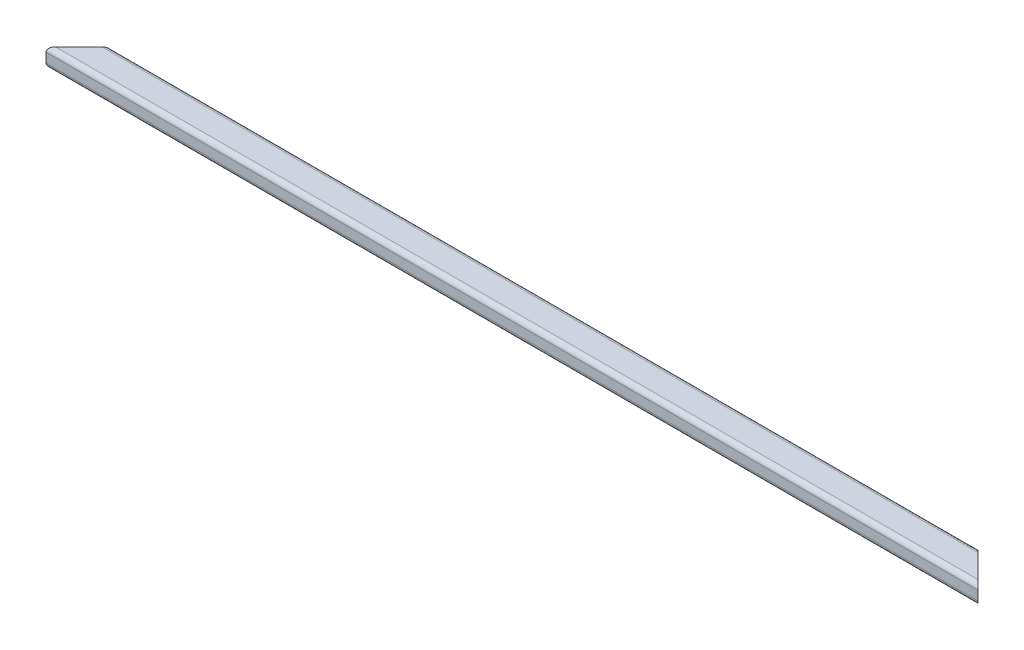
SolidWorks part; units mm, degrees
ref_plane "Plan1" through (0, 0, 0) normal (0, 0, 1) x (1, 0, 0)
ref_plane "Plan2" through (0, 0, 0) normal (0, 1, 0) x (1, 0, 0)
ref_plane "Plan3" through (0, 0, 0) normal (1, 0, 0) x (0, 0, -1)
sketch "Esquisse1" plane through (0, 0, 0) normal (1, 0, 0) x (0, 0, -1)
  line L0 (-17.5, 0) -> (17.5, 0) construction
  line L1 (-12.5, 10) -> (12.5, 10)
  line L2 (-17.5, 5) -> (-17.5, -5)
  line L3 (-12.5, -10) -> (12.5, -10)
  line L4 (17.5, 5) -> (17.5, -5)
  line L5 (0, -10) -> (0, 10) construction
  line L6 (-12.5, 7.5) -> (12.5, 7.5)
  line L7 (15, 5) -> (15, -5)
  line L8 (-12.5, -7.5) -> (12.5, -7.5)
  line L9 (-15, 5) -> (-15, -5)
  arc A0 (17.5, 5) -> (12.5, 10) centre (12.5, 5) ccw
  arc A1 (-17.5, 5) -> (-12.5, 10) centre (-12.5, 5) cw
  arc A2 (-12.5, -10) -> (-17.5, -5) centre (-12.5, -5) cw
  arc A3 (17.5, -5) -> (12.5, -10) centre (12.5, -5) cw
  arc A4 (-15, 5) -> (-12.5, 7.5) centre (-12.5, 5) cw
  arc A5 (15, 5) -> (12.5, 7.5) centre (12.5, 5) ccw
  arc A6 (15, -5) -> (12.5, -7.5) centre (12.5, -5) cw
  arc A7 (-12.5, -7.5) -> (-15, -5) centre (-12.5, -5) cw
  dimension "e" = 2.5
  dimension "C" = 20
  dimension "B" = 35
extrude "Base-Extrusion" add sketch "Esquisse1" along normal blind 1000
sketch "Esquisse2" plane through (0, 10, 0) normal (0, 1, 0) x (-1, 0, 0)
  line L0 (-1000, 17.5) -> (-965, -17.5)
  line L1 (-1000, -17.5) -> (0, -17.5) construction
  line L2 (-965, -17.5) -> (-1000, -17.5)
  line L3 (-1000, -17.5) -> (-1000, 17.5)
  line L4 (0, 17.5) -> (-35, -17.5)
  line L5 (-35, -17.5) -> (0, -17.5)
  line L6 (0, -17.5) -> (0, 17.5)
  dimension "D1" = 35
  dimension "D2" = 35
extrude "Enlèv. mat.-Extru.1" cut sketch "Esquisse2" against normal through all
